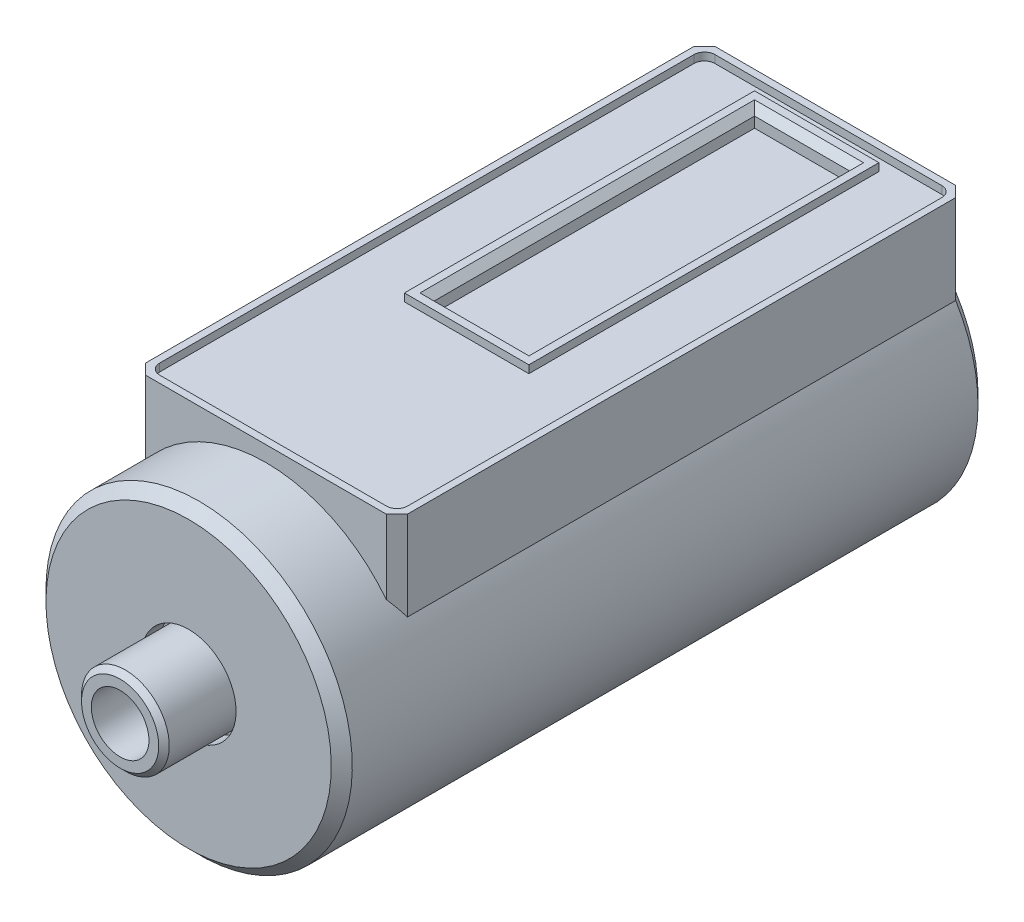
SolidWorks part; units mm, degrees
ref_plane "Front" through (0, 0, 0) normal (0, 0, 1) x (1, 0, 0)
ref_plane "Top" through (0, 0, 0) normal (0, 1, 0) x (1, 0, 0)
ref_plane "Right" through (0, 0, 0) normal (1, 0, 0) x (0, 0, -1)
sketch "Sketch2" plane through (0, 0, 0) normal (1, 0, 0) x (0, 0, -1)
  line L0 (46.735, 0) -> (46.735, 2.79)
  line L1 (47.115, 3.17) -> (52.955, 3.17)
  line L2 (51.685, 3.43) -> (51.685, 10.31)
  line L3 (52.445, 11.07) -> (98.425, 11.07)
  line L4 (98.425, 11.07) -> (98.425, 0)
  line L5 (98.425, 0) -> (46.735, 0)
  line L6 (51.685, 3.43) -> (52.955, 3.43)
  line L7 (52.955, 3.43) -> (52.955, 3.17)
  line L8 (46.735, 2.79) -> (47.115, 3.17)
  line L9 (51.685, 10.31) -> (52.445, 11.07)
  dimension "D1" = 51.69
  dimension "D2" = 3.17
  dimension "D3" = 11.07
  dimension "D4" = 4.95
  dimension "D5" = 1.27
  dimension "D6" = 3.43
  dimension "D7" = 2.79
  dimension "D8" = 0.38
  dimension "D9" = 0.76
  dimension "D10" = 10.31
  dimension "D11" = 98.425
revolve "Revolve1" add sketch "Sketch2" angle 360 about L5
sketch "Sketch3" plane through (0, 0, 0) normal (0, 1, 0) x (1, 0, 0)
  line L0 (11.07, 98.425) -> (-11.07, 98.425) construction
  line L1 (-9.46, 98.425) -> (9.46, 98.425)
  line L2 (-9.46, 98.425) -> (-9.46, 58.035)
  line L3 (-8.7, 57.275) -> (8.7, 57.275)
  line L4 (9.46, 98.425) -> (9.46, 58.035)
  line L5 (-9.46, 58.035) -> (-8.7, 57.275)
  line L6 (9.46, 58.035) -> (8.7, 57.275)
  point P1 (9.46, 57.275)
  point P2 (-9.46, 57.275)
  point P6 (0, 57.275)
  dimension "D1" = 41.15
  dimension "D2" = 18.92
extrude "Extrude1" add sketch "Sketch3" along normal blind 12.19
chamfer "Chamfer1" distance 0.76 angle 45 3 edges at (-9.46, 8.9696, -98.425) (0, -11.07, -98.425) (9.46, 8.9696, -98.425)
sketch "Sketch4" plane through (0, 12.19, 0) normal (0, 1, 0) x (1, 0, 0)
  line L0 (-8.7, 57.275) -> (8.7, 57.275) construction
  line L1 (-8.19, 97.915) -> (8.2, 97.915)
  line L2 (-8.95, 97.155) -> (-8.95, 58.545)
  line L3 (-8.19, 57.785) -> (8.2, 57.785)
  line L4 (8.96, 97.155) -> (8.96, 58.545)
  line L5 (-9.46, 58.035) -> (-9.46, 97.665) construction
  line L7 (-4.49, 97.075) -> (4.5, 97.075)
  line L8 (-4.49, 97.075) -> (-4.49, 71.775)
  line L9 (-4.49, 71.775) -> (4.5, 71.775)
  line L10 (4.5, 97.075) -> (4.5, 71.775)
  arc A0 (-8.95, 97.155) -> (-8.19, 97.915) centre (-8.19, 97.155) cw
  arc A1 (8.96, 97.155) -> (8.2, 97.915) centre (8.2, 97.155) ccw
  arc A2 (8.96, 58.545) -> (8.2, 57.785) centre (8.2, 58.545) cw
  arc A3 (-8.95, 58.545) -> (-8.19, 57.785) centre (-8.19, 58.545) ccw
  dimension "D5" = 0.76
  dimension "D1" = 17.91
  dimension "D2" = 40.13
  dimension "D3" = 0.51
  dimension "D4" = 0.51
  dimension "D6" = 0.84
  dimension "D7" = 4.46
  dimension "D8" = 4.46
  dimension "D9" = 25.3
extrude "Cut-Extrude1" cut sketch "Sketch4" against normal blind 0.56
sketch "Sketch5" plane through (0, 12.19, 0) normal (0, 1, 0) x (1, 0, 0)
  line L1 (-3.42, 96.005) -> (3.44, 96.005)
  line L2 (-3.42, 96.005) -> (-3.42, 72.845)
  line L3 (-3.42, 72.845) -> (3.44, 72.845)
  line L4 (3.44, 96.005) -> (3.44, 72.845)
  line L6 (4.5, 97.075) -> (-4.49, 97.075) construction
  line L7 (-4.49, 97.075) -> (-4.49, 71.775) construction
  point P4 (0.005, 97.075)
  dimension "D1" = 6.86
  dimension "D2" = 23.16
  dimension "D3" = 1.07
  dimension "D4" = 1.07
extrude "Cut-Extrude2" cut sketch "Sketch5" against normal blind 1.27
chamfer "Chamfer2" distance 0.51 angle 45 4 edges at (0.01, 12.19, -72.845) (3.44, 12.19, -84.425) (-3.42, 12.19, -84.425) (0.01, 12.19, -96.005)
hole_wizard "Hole1" positions "Sketch7" profile "Sketch6" legacy
sketch "Sketch7" plane through (0, 0, -46.735) normal (0, 0, 1) x (1, 0, 0)
  circle A0 centre (0, 0) radius 3.17 construction
  point P0 (0, 0)
sketch "Sketch6" plane through (0, 0, -46.735) normal (1, 0, 0) x (0, -1, 0)
  line L0 (0, 0) -> (0, 7.6015)
  line L1 (0, 7.6015) -> (2.0828, 6.35)
  line L2 (2.0828, 6.35) -> (2.0828, 0)
  line L4 (2.0828, 0) -> (0, 0)
  line L6 (0, 7.6015) -> (-2.0828, 6.35) construction
  line L7 (0, -4.2442) -> (0, 117.3081) construction
  dimension "Diameter" = 4.1656
  dimension "Depth" = 6.35
  dimension "Drill Angle" = 118
